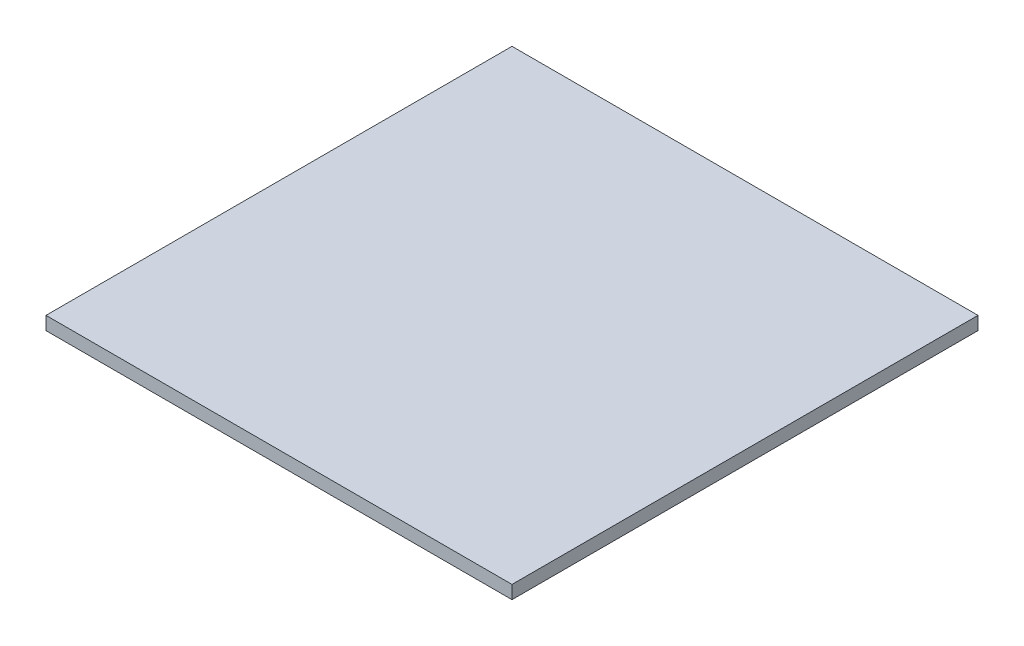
SolidWorks part; units mm, degrees
ref_plane "Front Plane" through (0, 0, 0) normal (0, 0, 1) x (1, 0, 0)
ref_plane "Top Plane" through (0, 0, 0) normal (0, 1, 0) x (1, 0, 0)
ref_plane "Right Plane" through (0, 0, 0) normal (1, 0, 0) x (0, 0, -1)
sketch "Sketch1" plane through (0, 0, 0) normal (0, 1, 0) x (1, 0, 0)
  line L1 (-88, 88) -> (88, 88)
  line L2 (-88, 88) -> (-88, -88)
  line L3 (-88, -88) -> (88, -88)
  line L4 (88, 88) -> (88, -88)
  line L5 (-88, 88) -> (88, -88) construction
  line L6 (-88, -88) -> (88, 88) construction
  point P0 (0, 0)
  dimension "D1" = 176
extrude "Boss-Extrude1" add sketch "Sketch1" along normal blind 5
sketch "Sketch2" plane through (0, 0, -88) normal (0, 0, -1) x (-1, 0, 0)
  line L0 (-7.7527, 0) -> (-7.7527, 5)
  line L1 (-88, 0) -> (88, 0) construction
  line L2 (-88, 5) -> (88, 5) construction
  line L3 (-7.7527, 5) -> (11.3578, 5)
  line L4 (11.3578, 5) -> (11.3578, -0.2028)
  line L5 (11.3578, -0.2028) -> (-7.7527, 0)
